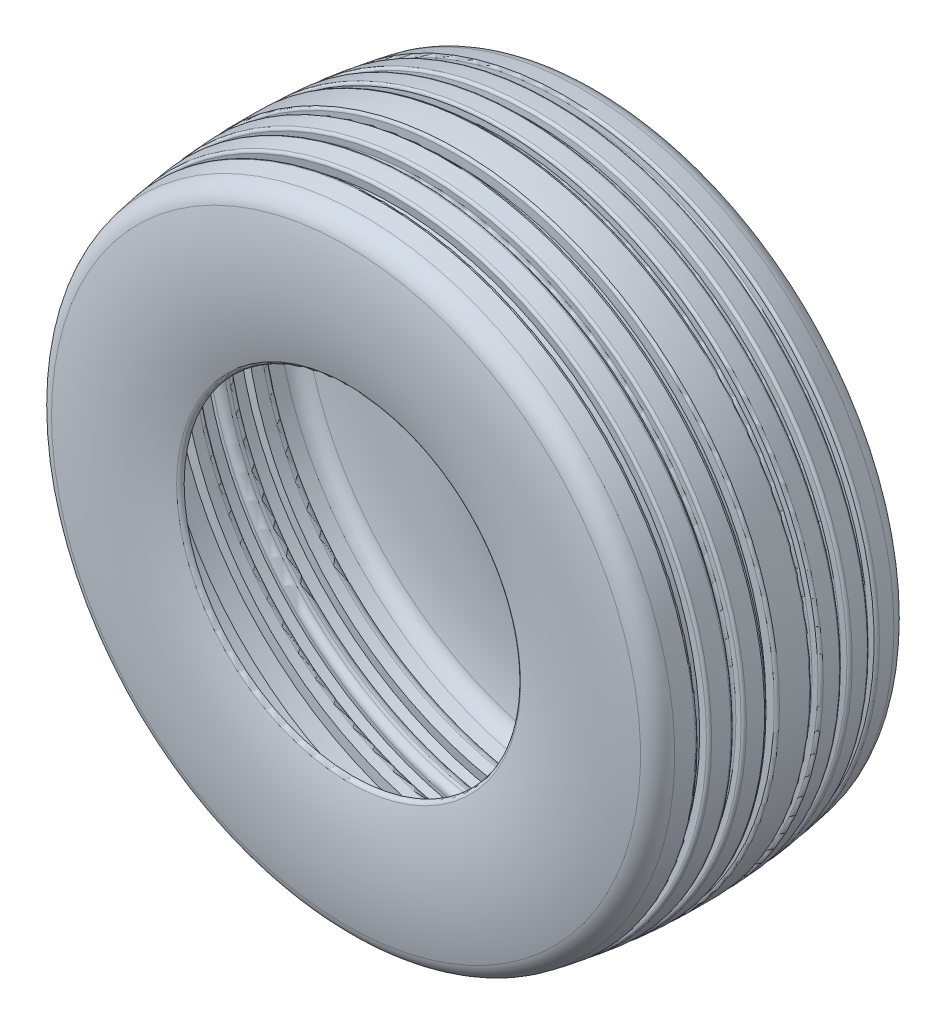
SolidWorks part; units mm, degrees
ref_plane "Front Plane" through (0, 0, 0) normal (0, 0, 1) x (1, 0, 0)
ref_plane "Top Plane" through (0, 0, 0) normal (0, 1, 0) x (1, 0, 0)
ref_plane "Right Plane" through (0, 0, 0) normal (1, 0, 0) x (0, 0, -1)
sketch "Sketch1" plane through (0, 0, 0) normal (1, 0, 0) x (0, 0, -1)
  line L0 (-376.4741, 0) -> (397.806, 0) construction
  line L1 (0, 0) -> (0, 700) construction
  line L2 (-280, 382.94) -> (280, 382.94)
  line L3 (-280, 700) -> (280, 700) construction
  line L4 (-280, 382.94) -> (-280, 700) construction
  line L5 (280, 700) -> (280, 382.94) construction
  arc A0 (-280, 700) -> (280, 700) centre (0, -591.6667) cw
  arc A1 (-280, 382.94) -> (-280, 700) centre (277.9142, 541.47) cw
  arc A2 (280, 700) -> (280, 382.94) centre (-277.9142, 541.47) cw
  point P10 (0, 730)
  dimension "D7" = 580
  dimension "D8" = 580
  dimension "D1" = 560
  dimension "D2" = 280
  dimension "D3" = 700
  dimension "D4" = 560
  dimension "D5" = 382.94
  dimension "D6" = 30
revolve "Revolve1" add sketch "Sketch1" angle 360 about L0
sketch "Sketch2" plane through (0, 0, 0) normal (1, 0, 0) x (0, 0, -1)
  line L0 (0, 0) -> (0, 730) construction
  line L1 (-40, 704.3829) -> (-40, 729.6054)
  line L2 (-60.5729, 728.6112) -> (-59.4271, 703.6375)
  line L3 (-111.8926, 729.571) -> (-109.4271, 700.4589)
  line L4 (-129.1904, 698.6328) -> (-131.8926, 725.6204)
  line L5 (-179.1904, 693.5795) -> (-182.8906, 720.1191)
  line L6 (-198.9702, 690.6663) -> (-202.8906, 715.9328)
  line L7 (-386.3675, 0) -> (386.3675, 0) construction
  line L8 (-202.8906, 715.9328) -> (-182.8906, 720.1191)
  line L9 (-131.8926, 725.6204) -> (-111.8926, 729.571)
  arc A0 (280, 700) -> (-280, 700) centre (0, -591.6667) ccw construction
  arc A3 (-179.1904, 693.5795) -> (-198.9702, 690.6663) centre (0, -591.6667) ccw
  arc A6 (-109.4271, 700.4589) -> (-129.1904, 698.6328) centre (0, -591.6667) ccw
  arc A7 (-40, 704.3829) -> (-59.4271, 703.6375) centre (0, -591.6667) ccw
  arc A9 (-60.5729, 728.6112) -> (-40, 729.6054) centre (13.5073, -590.9777) cw
  point P10 (-60, 716.1244)
  point P16 (-40, 730.3178)
  point P17 (-131.5716, 723.4347)
  point P22 (-40, 729.6054)
  point P25 (0, 0)
  point P27 (0, 0)
  point P28 (-111.6557, 726.9457)
  point P29 (0, 0)
  point P30 (-131.8926, 725.6204)
  point P31 (0, 0)
  point P32 (0, 0)
  point P33 (-202.8906, 715.9328)
  dimension "D2" = 40
  dimension "D3" = 20
  dimension "D4" = 50
  dimension "D5" = 20
  dimension "D6" = 50
  dimension "D1" = 20
revolve "Cut-Revolve1" cut sketch "Sketch2" angle 360 about L7
fillet "Fillet1" radius 6 7 edges at (-725.2858, 0, 111.5296) (700.4589, 0, 109.4271) (729.3946, 0, 40) (728.6112, 0, 60.5729) (-723.4246, 0, 131.6727) (-717.3388, 0, 182.503) (-714.3718, 0, 202.6484)
fillet "Fillet2" radius 6 3 edges at (703.6375, 0, 59.4271) (690.6663, 0, 198.9702) (698.6328, 0, 129.1904)
mirror "Mirror1" about plane through (0, 0, 0) normal (0, 0, 1) of "Cut-Revolve1", "Fillet1", "Fillet2"
fillet "Fillet3" radius 50 2 edges at (700, 0, -280) (700, 0, 280)
fillet "Fillet4" radius 10 2 edges at (382.94, 0, 280) (382.94, 0, -280)
shell "Shell1" thickness 10
